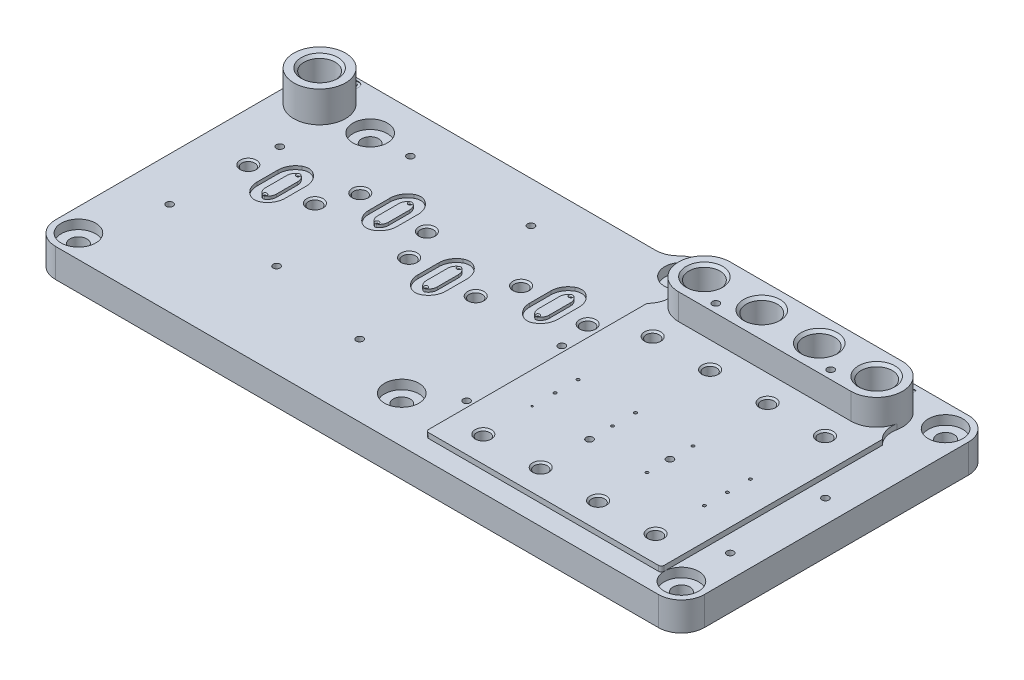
SolidWorks part; units mm, degrees
ref_plane "X_Y" through (0, 0, 0) normal (0, 0, 1) x (1, 0, 0)
ref_plane "Z_X" through (0, 0, 0) normal (0, 1, 0) x (1, 0, 0)
ref_plane "Y_Z" through (0, 0, 0) normal (1, 0, 0) x (0, 0, -1)
ref_plane "X_Y-_6021_master" through (0, 0, 0) normal (0, 0, 1) x (1, 0, 0)
ref_plane "Z_X_peltier-_6021_master" through (0, 0, 0) normal (0, 1, 0) x (1, 0, 0)
ref_plane "Y_Z-_6021_master" through (0, 0, 0) normal (1, 0, 0) x (0, 0, -1)
sketch "zx_sketch-_6021_master" plane through (0, 0, 0) normal (0, 1, 0) x (1, 0, 0)
  line L0 (0, 0) -> (0, 39833.2138) construction
  line L1 (-56.5, 24.66) -> (4, 24.66)
  line L2 (-56.5, 24.66) -> (-56.5, -27)
  line L3 (-56.5, -27) -> (56.5, -27)
  line L4 (56.5, 27) -> (56.5, -27)
  line L5 (0, 0) -> (39833.2138, 0) construction
  line L6 (4, 24.66) -> (4, 27)
  line L11 (4, 27) -> (56.5, 27)
  point P3 (0, -27)
  point P17 (-22.5, 15.66)
  point P18 (22.5, 15.66)
  point P19 (22.5, -15.66)
  point P20 (-22.5, -15.66)
  dimension "D1" = 113
  dimension "D2" = 24.66
  dimension "D3" = 45
  dimension "D4" = 31.32
  dimension "D5" = 27
  dimension "D6" = 2.34
  dimension "D7" = 4
  dimension "D8" = 27
sketch "xy_sketch-_6021_master" plane through (0, 0, 0) normal (0, 0, 1) x (1, 0, 0)
  line L0 (0, 0) -> (0, 5) construction
  line L1 (0, 5) -> (0, 10) construction
  dimension "D1" = 5
  dimension "D2" = 5
ref_plane "zx_lower_plate-_6021_master" through (0, 5, 0) normal (0, 1, 0) x (1, 0, 0)
ref_plane "zx_sensor-_6021_master" through (0, 10, 0) normal (0, 1, 0) x (1, 0, 0)
sketch "zx_sensor_sketch-_6021_master" plane through (0, 10, 0) normal (0, 1, 0) x (1, 0, 0)
  line L0 (-42.2, 3.16) -> (-28.2, 8.66) construction
  line L1 (-28.2, 8.66) -> (-14.2, 3.16) construction
  line L2 (-14.2, 3.16) -> (-0.2, 8.66) construction
  line L3 (-42.2, 4.96) -> (-42.2, -0.8) construction
  line L4 (-28.2, 10.46) -> (-28.2, 4.7) construction
  line L5 (-14.2, 4.96) -> (-14.2, -0.8) construction
  line L6 (-0.2, 10.46) -> (-0.2, 4.7) construction
  line L7 (-42.2, 3.16) -> (-42.2, -0.8) construction
  line L8 (-28.2, 8.66) -> (-28.2, 4.7) construction
  line L9 (-14.2, 3.16) -> (-14.2, -0.8) construction
  line L10 (-0.2, 8.66) -> (-0.2, 4.7) construction
  line L11 (-39.215, 3.16) -> (-45.185, 3.16) construction
  line L12 (-39.215, 7.475) -> (-39.215, -1.155) construction
  line L13 (-44.615, 3.16) -> (-39.785, 3.16) construction
  point P8 (-42.2, 2.08)
  point P16 (-42.2, 3.16)
  point P19 (-39.215, 3.16)
  point P22 (-42.2, 3.16)
  dimension "D3" = 14
  dimension "D4" = 1.08
  dimension "D6" = 5.76
  dimension "D7" = 5.97
  dimension "D9" = 8.63
  dimension "D10" = 4.83
  dimension "D11" = 5.5
sketch "zx_valve_sketch-_6021_master" plane through (0, 10.9, 0) normal (0, 1, 0) x (1, 0, 0)
  line L0 (44, -4.25) -> (34, -4.25) construction
  line L1 (34, -4.25) -> (24, -4.25) construction
  line L2 (24, -4.25) -> (14, -4.25) construction
  line L3 (44, -10.5) -> (44, -6.5) construction
  line L4 (44, -6.5) -> (44, -2.5) construction
  line L5 (34, -2.5) -> (34, -6.5) construction
  line L6 (34, -6.5) -> (34, -10.5) construction
  line L7 (24, -2.5) -> (24, -6.5) construction
  line L8 (24, -6.5) -> (24, -10.5) construction
  line L9 (14, -2.5) -> (14, -6.5) construction
  line L10 (14, -6.5) -> (14, -10.5) construction
  line L11 (44, 10.5) -> (44, -19) construction
  line L12 (34, 10.5) -> (34, -19) construction
  line L14 (24, -19) -> (24, 10.5) construction
  line L17 (14, 10.5) -> (14, -19) construction
  point P20 (44, -4.25)
  dimension "D1" = 10
  dimension "D4" = 8
  dimension "D5" = 2.25
  dimension "D6" = 29.5
sketch "zx_manifold_sketch-_6021_master" plane through (0, 5, 0) normal (0, 1, 0) x (1, 0, 0)
  line L0 (-34.0003, 7.58) -> (-22.3997, 7.58) construction
  line L4 (44, 19.5) -> (34, 19.5) construction
  line L5 (34, 19.5) -> (24, 19.5) construction
  line L6 (24, 19.5) -> (14, 19.5) construction
  line L7 (39, 10.5) -> (39, -7.6132)
  line L9 (-48.0003, 2.08) -> (-36.3997, 2.08) construction
  line L11 (-20.0003, 2.08) -> (-8.3997, 2.08) construction
  line L12 (-6.0003, 7.58) -> (5.6003, 7.58) construction
  line L13 (-48.9, -6.72) -> (-2.2958, -6.72)
  line L15 (14, -6.5) -> (24, -6.5)
  line L17 (-14.2, 4.96) -> (-9.7626, 10.5608)
  line L22 (34, -4.7265) -> (44, -4.7265) construction
  line L23 (44, -4.7265) -> (39, -7.6132) construction
  line L24 (-4.2467, 12.0482) -> (-0.2, 10.46)
  line L26 (44, 22) -> (14, 22)
  line L28 (-48.9, -14.72) -> (-30.3969, -14.72)
  line L30 (10.8896, -9.015) -> (7.7791, -11.53) construction
  line L31 (34, -14.5) -> (45, -14.5)
  line L32 (-22.5, -24) -> (44, -24)
  line L35 (-14.2, -0.8) -> (-18.2467, -2.3882)
  line L38 (-52.7667, 2.6469) -> (-51, 17.5)
  line L39 (-28.2, 4.7) -> (-23.7626, -0.9008)
  line L40 (14, 10.5) -> (22.5, 15.66) construction
  line L43 (49, -19) -> (49, -18.5)
  line L45 (-32.2467, 12.0482) -> (-28.2, 10.46)
  line L46 (-37.7626, 10.5608) -> (-42.2, 4.96)
  line L47 (-42.2, -0.8) -> (-46.2467, -2.3882)
  line L48 (-0.2, 4.7) -> (10.8896, -9.015)
  circle A0 centre (34, 19.5) radius 3.85 construction
  circle A1 centre (44, 19.5) radius 3.85 construction
  circle A2 centre (24, 19.5) radius 3.85 construction
  circle A3 centre (14, 19.5) radius 3.85 construction
  arc A4 (34, -10.5) -> (39, -7.6132) centre (34, -4.7265) ccw
  arc A6 (29, 10.5) -> (34, -2.5) centre (48.4, 10.5) ccw
  arc A7 (44, -10.5) -> (39, -7.6132) centre (44, -4.7265) cw
  arc A8 (44, -2.5) -> (49, 10.5) centre (29.6, 10.5) ccw
  arc A11 (45.3208, 21.6226) -> (44, 22) centre (44, 19.5) ccw
  arc A12 (44, -6.5) -> (51.5, 10.5) centre (28.4833, 10.5) ccw
  arc A13 (14, 22) -> (11.6636, 20.3896) centre (14, 19.5) ccw
  arc A15 (34, -14.5) -> (34, -6.5) centre (34, -10.5) cw
  arc A16 (-48.9, -6.72) -> (-48.9, -14.72) centre (-48.9, -10.72) ccw
  arc A17 (44, -24) -> (49, -19) centre (44, -19) ccw
  arc A18 (-22.5, -24) -> (-26.4485, -19.36) centre (-22.5, -20) cw
  arc A19 (-30.3969, -14.72) -> (-26.4485, -19.36) centre (-30.3969, -18.72) cw
  arc A20 (14, -10.5) -> (10.8896, -9.015) centre (14, -6.5) cw
  arc A21 (-4.2467, 12.0482) -> (-9.7626, 10.5608) centre (-6.0003, 7.58) ccw
  circle A22 centre (-51, 17.5) radius 3.85 construction
  arc A23 (-23.7626, -0.9008) -> (-18.2467, -2.3882) centre (-20.0003, 2.08) ccw
  arc A24 (-32.2467, 12.0482) -> (-37.7626, 10.5608) centre (-34.0003, 7.58) ccw
  arc A25 (-46.2467, -2.3882) -> (-52.7667, 2.6469) centre (-48.0003, 2.08) cw
  arc A26 (49, -18.5) -> (45, -14.5) centre (45, -18.5) ccw
  circle A27 centre (-51, 17.5) radius 5.5 construction
  arc A29 (14, 19.5) -> (19, 10.5) centre (8.4, 10.5) cw
  arc A30 (39, 10.5) -> (34, 19.5) centre (28.4, 10.5) ccw
  arc A31 (49, 10.5) -> (44, 19.5) centre (38.4, 10.5) ccw
  arc A32 (29, 10.5) -> (24, 19.5) centre (18.4, 10.5) ccw
  arc A33 (19, 10.5) -> (24, -2.5) centre (38.4, 10.5) ccw
  arc A35 (45.3208, 21.6226) -> (51.5, 10.5) centre (38.4, 10.5) cw
  arc A36 (14, -2.5) -> (11.6636, 20.3896) centre (35.6147, 11.2703) cw
  arc A37 (19.5172, -12.2931) -> (7.7791, -11.53) centre (14, -6.5) cw
  arc A38 (7.7791, -11.53) -> (-2.2958, -6.72) centre (-2.2958, -19.6763) ccw
  arc A39 (24, -10.5) -> (19.5172, -12.2931) centre (24, -17) ccw
  point P121 (-42.2, 2.08)
  dimension "D1" = 30
  dimension "D2" = 7.7
  dimension "D4" = 2.5
  dimension "D5" = 4
  dimension "D6" = 92.9
  dimension "D9" = 4
  dimension "D15" = 4
  dimension "D18" = 4.8
  dimension "D11" = 4
sketch "zx_screws_sketch-_6021_master" plane through (0, 5, 0) normal (0, 1, 0) x (1, 0, 0)
  line L4 (-34.0003, 7.58) -> (-22.3997, 7.58) construction
  line L5 (-20.0003, 2.08) -> (-8.3997, 2.08) construction
  line L6 (-6.0003, 7.58) -> (5.6003, 7.58) construction
  line L7 (-36.3997, 2.08) -> (-48.0003, 2.08) construction
  line L13 (56.5, 27) -> (56.5, -27) construction
  circle A0 centre (52.5, 23) radius 4 construction
  circle A3 centre (52.5, -23) radius 4 construction
  arc A7 (-52.7667, 2.6469) -> (-46.2467, -2.3882) centre (-48.0003, 2.08) ccw construction
  circle A8 centre (-52.5, -23) radius 4 construction
  point P0 (-0.2, -19)
  point P1 (52.5, -23)
  point P2 (52.5, 23)
  point P3 (6.6, 23)
  point P4 (-52.5, -23)
  point P5 (-42.2, 17.5)
ref_plane "yz_sensor-_6021_master" through (-42.2, 0, 0) normal (1, 0, 0) x (0, 0, -1)
ref_plane "zx_valve-_6021_master" through (0, 10.9, 0) normal (0, 1, 0) x (1, 0, 0)
ref_plane "zx_sensor_shelf-_6021_master" through (0, 12.391, 0) normal (0, 1, 0) x (1, 0, 0)
sketch "xz_cover-_6021_master" plane through (0, 0, 0) normal (0, 1, 0) x (1, 0, 0)
  line L1 (-63, -36.79) -> (63, -36.79)
  line L2 (-71.85, -27.94) -> (-71.85, 30.02)
  line L3 (-71.85, 30.02) -> (71.85, 30.02)
  line L4 (71.85, -27.94) -> (71.85, 30.02)
  line L5 (-71.85, -36.79) -> (71.85, 30.02) construction
  line L6 (-71.85, 30.02) -> (71.85, -36.79) construction
  line L7 (0, -1003.385) -> (0, 48996.615) construction
  arc A0 (71.85, -27.94) -> (63, -36.79) centre (63, -27.94) cw
  arc A1 (-63, -36.79) -> (-71.85, -27.94) centre (-63, -27.94) cw
  circle A2 centre (-64.495, 5.21) radius 3.6
  circle A3 centre (64.495, 5.21) radius 3.6
  point P0 (0, -3.385)
  dimension "D4" = 8.85
  dimension "D5" = 42
  dimension "D7" = 7.2
  dimension "D1" = 66.81
  dimension "D2" = 143.7
  dimension "D6" = 128.99
inserted part "_6021_master"
sketch "Sketch7" plane through (0, 5, 0) normal (0, 1, 0) x (1, 0, 0)
  line L0 (-56.5, -27) -> (56.5, -27) construction
  line L1 (56.5, 27) -> (56.5, -27) construction
  line L2 (4, 27) -> (56.5, 27) construction
  line L3 (4, 24.66) -> (4, 27) construction
  line L4 (-56.5, 24.66) -> (4, 24.66) construction
  line L5 (-56.5, 24.66) -> (-56.5, -27) construction
  line L6 (-56.5, -27) -> (56.5, -27)
  line L7 (56.5, 27) -> (56.5, -27)
  line L8 (4, 27) -> (56.5, 27)
  line L9 (4, 24.66) -> (4, 27)
  line L10 (-56.5, 24.66) -> (4, 24.66)
  line L11 (-56.5, 24.66) -> (-56.5, -27)
  circle A0 centre (-42.2, 4.96) radius 0.15
  circle A1 centre (-42.2, -0.8) radius 0.15
  circle A2 centre (-28.2, 10.46) radius 0.15
  circle A3 centre (-28.2, 4.7) radius 0.15
  circle A4 centre (-14.2, 4.96) radius 0.15
  circle A5 centre (-14.2, -0.8) radius 0.15
  circle A6 centre (-0.2, 10.46) radius 0.15
  circle A7 centre (-0.2, 4.7) radius 0.15
  circle A8 centre (14, -2.5) radius 0.25
  circle A9 centre (14, -6.5) radius 0.25
  circle A10 centre (14, -10.5) radius 0.15
  circle A11 centre (24, -2.5) radius 0.25
  circle A12 centre (24, -6.5) radius 0.25
  circle A13 centre (24, -10.5) radius 0.6
  circle A14 centre (34, -2.5) radius 0.25
  circle A15 centre (34, -6.5) radius 0.6
  circle A16 centre (34, -10.5) radius 0.25
  circle A17 centre (44, -2.5) radius 0.25
  circle A18 centre (44, -6.5) radius 0.25
  circle A19 centre (44, -10.5) radius 0.25
  circle A20 centre (-51, 17.5) radius 0.25
  circle A21 centre (14, 19.5) radius 0.25
  circle A22 centre (24, 19.5) radius 0.25
  circle A23 centre (34, 19.5) radius 0.25
  circle A24 centre (44, 19.5) radius 0.25
  dimension "D1" = 0.3
  dimension "D2" = 0.5
  dimension "D3" = 1.2
extrude "Boss-Extrude1" add sketch "Sketch7" along normal up to surface (5 mm away)
sketch "Sketch8" plane through (0, 10, 0) normal (0, 1, 0) x (1, 0, 0)
  line L2 (14, 24) -> (44, 24)
  line L3 (14, 15) -> (44, 15)
  circle A0 centre (-51, 17.5) radius 4.5
  arc A1 (14, 24) -> (14, 15) centre (14, 19.5) ccw
  arc A2 (44, 24) -> (44, 15) centre (44, 19.5) cw
  circle A3 centre (44, 19.5) radius 0.25 construction
  circle A4 centre (34, 19.5) radius 0.25 construction
  circle A5 centre (24, 19.5) radius 0.25 construction
  circle A6 centre (14, 19.5) radius 0.25 construction
  circle A7 centre (-51, 17.5) radius 0.25 construction
  circle A8 centre (44, 19.5) radius 0.25
  circle A9 centre (34, 19.5) radius 0.25
  circle A10 centre (24, 19.5) radius 0.25
  circle A11 centre (14, 19.5) radius 0.25
  circle A12 centre (-51, 17.5) radius 0.25
  dimension "D1" = 9
extrude "Boss-Extrude2" add sketch "Sketch8" along normal blind 5.4
sketch "Sketch17" plane through (0, 10, 0) normal (0, 1, 0) x (1, 0, 0)
  line L1 (8.5, 15) -> (49.5, 15)
  line L2 (8.5, 15) -> (8.5, -23.5)
  line L3 (8.5, -23.5) -> (49.5, -23.5)
  line L4 (49.5, 15) -> (49.5, -23.5)
  line L11 (34, -4.25) -> (24, -4.25) construction
  line L31 (14, 15) -> (44, 15) construction
  circle A0 centre (44, -2.5) radius 0.25 construction
  circle A1 centre (34, -2.5) radius 0.25 construction
  circle A2 centre (24, -2.5) radius 0.25 construction
  circle A3 centre (14, -2.5) radius 0.25 construction
  circle A4 centre (44, -2.5) radius 0.25
  circle A5 centre (34, -2.5) radius 0.25
  circle A6 centre (24, -2.5) radius 0.25
  circle A7 centre (14, -2.5) radius 0.25
  circle A8 centre (44, -6.5) radius 0.25 construction
  circle A9 centre (34, -6.5) radius 0.6 construction
  circle A10 centre (24, -6.5) radius 0.25 construction
  circle A11 centre (14, -6.5) radius 0.25 construction
  circle A12 centre (44, -6.5) radius 0.25
  circle A13 centre (34, -6.5) radius 0.6
  circle A14 centre (24, -6.5) radius 0.25
  circle A15 centre (14, -6.5) radius 0.25
  circle A16 centre (44, -10.5) radius 0.25 construction
  circle A17 centre (34, -10.5) radius 0.25 construction
  circle A18 centre (24, -10.5) radius 0.6 construction
  circle A19 centre (14, -10.5) radius 0.15 construction
  circle A20 centre (44, -10.5) radius 0.25
  circle A21 centre (34, -10.5) radius 0.25
  circle A22 centre (24, -10.5) radius 0.6
  circle A23 centre (14, -10.5) radius 0.15
  circle A27 centre (44, 19.5) radius 0.25 construction
  circle A28 centre (34, 19.5) radius 0.25 construction
  circle A29 centre (24, 19.5) radius 0.25 construction
  circle A30 centre (14, 19.5) radius 0.25 construction
  circle A32 centre (44, 19.5) radius 0.25
  circle A33 centre (34, 19.5) radius 0.25
  circle A34 centre (24, 19.5) radius 0.25
  circle A35 centre (14, 19.5) radius 0.25
  point P51 (29, -23.5)
  point P60 (29, -4.25)
  point P64 (49.5, -4.25)
  dimension "D1" = 38.5
  dimension "D2" = 41
extrude "Boss-Extrude3" add sketch "Sketch17" along normal blind 0.9
hole_wizard "1/4-28 Tapped Hole1" positions "Sketch9" profile "Sketch10" tap size "1/4-28" standard "ANSI Inch"
sketch "Sketch9" plane through (0, 15.4, 0) normal (0, 1, 0) x (1, 0, 0)
  point P0 (-51, 17.5)
  point P3 (14, 19.5)
  point P6 (24, 19.5)
  point P9 (34, 19.5)
  point P12 (44, 19.5)
sketch "Sketch10" plane through (-51, 15.4, -17.5) normal (1, 0, 0) x (0, 0, 1)
  line L0 (0, 0) -> (0, 8.89)
  line L1 (0, 8.89) -> (2.7051, 8.89)
  line L2 (2.7051, 8.89) -> (2.7051, 0.4699)
  line L3 (2.7051, 0.4699) -> (3.175, 0)
  line L5 (3.175, 0) -> (0, 0)
  line L6 (-2.7051, 0.4699) -> (-3.175, 0) construction
  line L10 (0, 8.89) -> (-2.7051, 8.89) construction
  line L11 (0, -6.35) -> (0, 107.95) construction
  dimension "Tap Drill Dia." = 5.4102
  dimension "Tap Drill Depth" = 8.89
  dimension "Near C'Sink Dia." = 6.35
  dimension "Near C'Sink Angle" = 90
  dimension "Drill Angle" = 180
sketch "Sketch29" plane through (0, 10, 0) normal (0, 1, 0) x (1, 0, 0)
  line L4 (8.5, 15) -> (8.5, -23.5)
  line L5 (8.5, -23.5) -> (49.5, -23.5)
  line L6 (49.5, 15) -> (49.5, -23.5)
  line L7 (8.5, 15) -> (49.5, 15)
  line L8 (34, -4.25) -> (24, -4.25) construction
  point P5 (29, -4.25)
  point P7 (29, -23.5)
  point P8 (49.5, -4.25)
  dimension "D1" = 38.5
  dimension "D2" = 41
hole_wizard "CBORE for #4 Binding Head Machine Screw1" positions "Sketch11" profile "Sketch12" counterbore size "#4" standard "ANSI Inch"
sketch "Sketch11" plane through (0, 10, 0) normal (0, 1, 0) x (1, 0, 0)
  point P0 (-42.2, 17.5)
  point P3 (-52.5, -23)
  point P6 (-0.2, -19)
  point P9 (6.6, 23)
  point P12 (52.5, 23)
  point P15 (52.5, -23)
sketch "Sketch12" plane through (-42.2, 10, -17.5) normal (1, 0, 0) x (0, 0, 1)
  line L0 (0, 0) -> (0, 5)
  line L1 (0, 5) -> (1.4732, 5)
  line L3 (1.4732, 5) -> (1.4732, 1.6002)
  line L4 (1.4732, 1.6002) -> (2.9997, 1.6002)
  line L5 (2.9997, 1.6002) -> (2.9997, 0)
  line L7 (2.9997, 0) -> (0, 0)
  line L11 (0, -6.35) -> (0, 107.95) construction
  dimension "Thru Hole Dia." = 2.9464
  dimension "Thru Hole Depth" = 5
  dimension "C'Bore Dia." = 5.9995
  dimension "C'Bore Depth" = 1.6002
hole_wizard "#4-40 Tapped Hole1" positions "Sketch13" profile "Sketch14" tap size "#4-40" standard "ANSI Inch"
sketch "Sketch13" plane through (0, 10, 0) normal (0, 1, 0) x (1, 0, 0)
  point P0 (-48.0003, 2.08)
  point P3 (-36.3997, 2.08)
  point P6 (-34.0003, 7.58)
  point P9 (-22.3997, 7.58)
  point P12 (-20.0003, 2.08)
  point P15 (-8.3997, 2.08)
  point P18 (-6.0003, 7.58)
  point P21 (5.6003, 7.58)
sketch "Sketch14" plane through (-48.0003, 10, -2.08) normal (1, 0, 0) x (0, 0, 1)
  line L0 (0, 0) -> (0, 5)
  line L1 (0, 5) -> (1.1303, 5)
  line L2 (1.1303, 5) -> (1.1303, 0.2921)
  line L3 (1.1303, 0.2921) -> (1.4224, 0)
  line L5 (1.4224, 0) -> (0, 0)
  line L6 (-1.1303, 0.2921) -> (-1.4224, 0) construction
  line L11 (0, -6.35) -> (0, 107.95) construction
  dimension "Thru Tap Drill Dia." = 2.2606
  dimension "Thru Tap Drill Depth" = 5
  dimension "Near C'Sink Dia." = 2.8448
  dimension "Near C'Sink Angle" = 90
hole_wizard "#4-40 Tapped Hole2" positions "Sketch18" profile "Sketch19" tap size "#4-40" standard "ANSI Inch"
sketch "Sketch18" plane through (0, 10.9, 0) normal (0, 1, 0) x (1, 0, 0)
  point P0 (14, 10.5)
  point P3 (24, 10.5)
  point P6 (34, 10.5)
  point P9 (44, 10.5)
  point P12 (14, -19)
  point P15 (24, -19)
  point P18 (34, -19)
  point P21 (44, -19)
sketch "Sketch19" plane through (14, 10.9, -10.5) normal (1, 0, 0) x (0, 0, 1)
  line L0 (0, 0) -> (0, 5.9)
  line L1 (0, 5.9) -> (1.1303, 5.9)
  line L2 (1.1303, 5.9) -> (1.1303, 0.2921)
  line L3 (1.1303, 0.2921) -> (1.4224, 0)
  line L5 (1.4224, 0) -> (0, 0)
  line L6 (-1.1303, 0.2921) -> (-1.4224, 0) construction
  line L11 (0, -6.35) -> (0, 107.95) construction
  dimension "Thru Tap Drill Dia." = 2.2606
  dimension "Thru Tap Drill Depth" = 5.9
  dimension "Near C'Sink Dia." = 2.8448
  dimension "Near C'Sink Angle" = 90
sketch "Sketch15" plane through (0, 10, 0) normal (0, 1, 0) x (1, 0, 0)
  line L1 (-42.2, 4.96) -> (-42.2, -0.8) construction
  line L2 (-46.025, 2.08) -> (-45.0281, 2.08) construction
  line L7 (-41.25, 3.9208) -> (-41.25, 0.2392)
  line L8 (-43.15, 3.9208) -> (-43.15, 0.2392)
  line L9 (-42.8, 3.9208) -> (-42.2, 4.96) construction
  line L10 (-42.2, 4.96) -> (-42.35, 4.96) construction
  arc A0 (-42.375, 5.2631) -> (-42.025, 5.2631) centre (-42.2, 4.96) cw
  circle A1 centre (-42.2, 4.96) radius 0.15 construction
  arc A2 (-42.375, 5.2631) -> (-43.15, 3.9208) centre (-41.6, 3.9208) ccw
  arc A3 (-42.025, 5.2631) -> (-41.25, 3.9208) centre (-42.8, 3.9208) cw
  arc A4 (-42.025, -1.1031) -> (-41.25, 0.2392) centre (-42.8, 0.2392) ccw
  arc A5 (-42.375, -1.1031) -> (-43.15, 0.2392) centre (-41.6, 0.2392) cw
  arc A6 (-42.375, -1.1031) -> (-42.025, -1.1031) centre (-42.2, -0.8) ccw
  point P12 (-42.2, 2.08)
  dimension "D1" = 1.9
  dimension "D3" = 0.2
  dimension "D2" = 60
extrude "flowcell_cut" cut sketch "Sketch15" against normal blind 0.1
chamfer "Chamfer1" distance 0.2 angle 45 2 edges at (-42.2, 9.9, 0.65) (-42.2, 9.9, -5.11)
sketch "Sketch16" plane through (0, 10, 0) normal (0, 1, 0) x (1, 0, 0)
  line L2 (-41.25, 0.2392) -> (-41.25, 3.9208)
  line L3 (-43.15, 3.9208) -> (-43.15, 0.2392)
  line L8 (-41.25, 0.2392) -> (-41.25, 3.9208)
  line L9 (-43.15, 3.9208) -> (-43.15, 0.2392)
  line L64 (-39.75, 0.2392) -> (-39.75, 3.9208)
  line L65 (-44.65, 3.9208) -> (-44.65, 0.2392)
  line L66 (-39.75, 0.2392) -> (-39.75, 3.9208)
  line L67 (-44.65, 3.9208) -> (-44.65, 0.2392)
  arc A6 (-41.25, 3.9208) -> (-42.025, 5.2631) centre (-42.8, 3.9208) ccw
  arc A7 (-42.025, -1.1031) -> (-41.25, 0.2392) centre (-42.8, 0.2392) ccw
  arc A8 (-42.375, -1.1031) -> (-42.025, -1.1031) centre (-42.2, -0.8) ccw
  arc A9 (-43.15, 0.2392) -> (-42.375, -1.1031) centre (-41.6, 0.2392) ccw
  arc A10 (-42.375, 5.2631) -> (-43.15, 3.9208) centre (-41.6, 3.9208) ccw
  arc A11 (-42.375, -1.1031) -> (-42.025, -1.1031) centre (-42.2, -0.8) ccw
  arc A24 (-41.25, 3.9208) -> (-42.025, 5.2631) centre (-42.8, 3.9208) ccw
  arc A25 (-42.025, -1.1031) -> (-41.25, 0.2392) centre (-42.8, 0.2392) ccw
  arc A27 (-43.15, 0.2392) -> (-42.375, -1.1031) centre (-41.6, 0.2392) ccw
  arc A28 (-42.375, 5.2631) -> (-43.15, 3.9208) centre (-41.6, 3.9208) ccw
  arc A30 (-39.75, 3.9208) -> (-41.275, 6.5621) centre (-42.8, 3.9208) ccw
  arc A31 (-41.275, -2.4021) -> (-39.75, 0.2392) centre (-42.8, 0.2392) ccw
  arc A32 (-43.125, -2.4021) -> (-41.275, -2.4021) centre (-42.2, -0.8) ccw
  arc A33 (-44.65, 0.2392) -> (-43.125, -2.4021) centre (-41.6, 0.2392) ccw
  arc A34 (-43.125, 6.5621) -> (-44.65, 3.9208) centre (-41.6, 3.9208) ccw
  arc A35 (-43.125, -2.4021) -> (-41.275, -2.4021) centre (-42.2, -0.8) ccw
  arc A36 (-39.75, 3.9208) -> (-41.275, 6.5621) centre (-42.8, 3.9208) ccw
  arc A37 (-41.275, -2.4021) -> (-39.75, 0.2392) centre (-42.8, 0.2392) ccw
  arc A39 (-44.65, 0.2392) -> (-43.125, -2.4021) centre (-41.6, 0.2392) ccw
  arc A40 (-43.125, 6.5621) -> (-44.65, 3.9208) centre (-41.6, 3.9208) ccw
  arc A44 (-41.275, 6.5621) -> (-43.125, 6.5621) centre (-42.2, 4.96) ccw
  arc A45 (-41.275, 6.5621) -> (-43.125, 6.5621) centre (-42.2, 4.96) ccw
  arc A46 (-42.025, 5.2631) -> (-42.375, 5.2631) centre (-42.2, 4.96) ccw
  arc A47 (-42.025, 5.2631) -> (-42.375, 5.2631) centre (-42.2, 4.96) ccw
  dimension "D2" = 0
  dimension "D4" = 1.5
extrude "gland_cut" cut sketch "Sketch16" against normal blind 0.6
pattern_linear "LPattern17" count 4 spacing 14 along (1, 0, 0) count 2 spacing 5.5 of "gland_cut", "flowcell_cut"
pattern_linear "LPattern19" count 4 spacing 14 along (1, 0, 0) count 2 spacing 5.5 of "Chamfer1"
sketch "Sketch20" plane through (0, 5, 0) normal (0, -1, 0) x (1, 0, 0)
  line L2 (10.7729, 9.1093) -> (-0.3166, -4.6057)
  line L3 (10.7729, 9.1093) -> (-0.3166, -4.6057)
  line L4 (-42.3176, -5.0531) -> (-37.8802, -10.6539)
  line L5 (-32.1919, -12.1878) -> (-28.1452, -10.5996)
  line L6 (-42.3176, -5.0531) -> (-37.8802, -10.6539)
  line L7 (-32.1919, -12.1878) -> (-28.1452, -10.5996)
  line L8 (-42.0824, -4.8669) -> (-37.645, -10.4676)
  line L9 (-32.3015, -11.9086) -> (-28.2548, -10.3204)
  line L10 (-42.0824, -4.8669) -> (-37.645, -10.4676)
  line L11 (-32.3015, -11.9086) -> (-28.2548, -10.3204)
  line L12 (11.0062, 8.9207) -> (-0.0834, -4.7943)
  line L13 (11.0062, 8.9207) -> (-0.0834, -4.7943)
  line L14 (-18.3015, 2.2486) -> (-14.2548, 0.6604)
  line L15 (-28.0824, -4.7931) -> (-23.645, 0.8076)
  line L16 (-18.3015, 2.2486) -> (-14.2548, 0.6604)
  line L17 (-28.0824, -4.7931) -> (-23.645, 0.8076)
  line L18 (-18.1919, 2.5278) -> (-14.1452, 0.9396)
  line L19 (-28.3176, -4.6069) -> (-23.8802, 0.9939)
  line L20 (-18.1919, 2.5278) -> (-14.1452, 0.9396)
  line L21 (-28.3176, -4.6069) -> (-23.8802, 0.9939)
  line L23 (-42.3176, -5.0531) -> (-42.0824, -4.8669)
  line L24 (-4.1919, -12.1878) -> (-0.1452, -10.5996)
  line L25 (-14.3176, -5.0531) -> (-9.8802, -10.6539)
  line L26 (-4.1919, -12.1878) -> (-0.1452, -10.5996)
  line L27 (-14.3176, -5.0531) -> (-9.8802, -10.6539)
  line L28 (-4.3015, -11.9086) -> (-0.2548, -10.3204)
  line L29 (-14.0824, -4.8669) -> (-9.645, -10.4676)
  line L30 (-4.3015, -11.9086) -> (-0.2548, -10.3204)
  line L31 (-14.0824, -4.8669) -> (-9.645, -10.4676)
  line L36 (-28.1452, -10.5996) -> (-28.2548, -10.3204)
  line L37 (-28.0824, -4.7931) -> (-28.3176, -4.6069)
  line L38 (-14.2548, 0.6604) -> (-14.1452, 0.9396)
  line L39 (-14.3176, -5.0531) -> (-14.0824, -4.8669)
  line L40 (-0.1452, -10.5996) -> (-0.2548, -10.3204)
  line L41 (-0.0834, -4.7943) -> (-0.3166, -4.6057)
  line L42 (14, 10.35) -> (14, 10.65)
  arc A2 (-37.8802, -10.6539) -> (-32.1919, -12.1878) centre (-34.0003, -7.58) ccw
  arc A3 (-37.8802, -10.6539) -> (-32.1919, -12.1878) centre (-34.0003, -7.58) ccw
  arc A4 (-37.645, -10.4676) -> (-32.3015, -11.9086) centre (-34.0003, -7.58) ccw
  arc A5 (-37.645, -10.4676) -> (-32.3015, -11.9086) centre (-34.0003, -7.58) ccw
  arc A7 (-18.3015, 2.2486) -> (-23.645, 0.8076) centre (-20.0003, -2.08) ccw
  arc A8 (-18.3015, 2.2486) -> (-23.645, 0.8076) centre (-20.0003, -2.08) ccw
  arc A9 (-18.1919, 2.5278) -> (-23.8802, 0.9939) centre (-20.0003, -2.08) ccw
  arc A10 (-18.1919, 2.5278) -> (-23.8802, 0.9939) centre (-20.0003, -2.08) ccw
  arc A11 (14, 10.65) -> (10.7729, 9.1093) centre (14, 6.5) ccw
  arc A12 (-9.8802, -10.6539) -> (-4.1919, -12.1878) centre (-6.0003, -7.58) ccw
  arc A13 (-9.8802, -10.6539) -> (-4.1919, -12.1878) centre (-6.0003, -7.58) ccw
  arc A14 (-9.645, -10.4676) -> (-4.3015, -11.9086) centre (-6.0003, -7.58) ccw
  arc A15 (-9.645, -10.4676) -> (-4.3015, -11.9086) centre (-6.0003, -7.58) ccw
  arc A16 (14, 10.65) -> (10.7729, 9.1093) centre (14, 6.5) ccw
  arc A17 (14, 10.35) -> (11.0062, 8.9207) centre (14, 6.5) ccw
  arc A19 (14, 10.35) -> (11.0062, 8.9207) centre (14, 6.5) ccw
  dimension "D1" = 0.15
  dimension "D2" = 0.15
  dimension "D3" = 0.15
  dimension "D4" = 0.15
  dimension "D5" = 0.15
  dimension "D6" = 0.15
  dimension "D7" = 0.15
  dimension "D8" = 0.15
extrude "manifold_cut1" cut sketch "Sketch20" against normal blind 0.5
sketch "Sketch21" plane through (0, 5, 0) normal (0, -1, 0) x (1, 0, 0)
  line L0 (14, 2.5) -> (14, 6.5) construction
  line L1 (24, 6.5) -> (24, 10.5) construction
  line L2 (14, 6.25) -> (24, 6.25)
  line L3 (14, 6.25) -> (14, 6.75)
  line L4 (-53.015, -2.6765) -> (-51.2483, -17.5295)
  line L5 (-42.1087, 1.0327) -> (-46.1553, 2.6209)
  line L6 (-53.015, -2.6765) -> (-51.2483, -17.5295)
  line L7 (-42.2018, 1.0693) -> (-46.1553, 2.6209)
  line L8 (-52.5185, -2.6174) -> (-50.7517, -17.4705)
  line L9 (-42.2913, 0.5673) -> (-46.338, 2.1555)
  line L10 (-52.5185, -2.6174) -> (-50.7517, -17.4705)
  line L11 (-42.3844, 0.6038) -> (-46.338, 2.1555)
  line L12 (14, 6.75) -> (24, 6.75)
  line L13 (24, 6.25) -> (24, 6.75)
  line L22 (-51.2483, -17.5295) -> (-50.7517, -17.4705)
  line L23 (39.25, -10.5) -> (39.25, 7.5455)
  line L24 (39.25, -10.5) -> (39.25, 7.5455)
  line L25 (38.75, -10.5) -> (38.75, 7.6795)
  line L26 (38.75, -10.5) -> (38.75, 7.5455)
  line L27 (-42.2, 0.8) -> (-46.2467, 2.3882) construction
  line L28 (13.7892, 2.6343) -> (14.2108, 2.3657)
  line L29 (14.1321, -19.7123) -> (13.8679, -19.2877)
  line L30 (23.8144, 2.6675) -> (24.1856, 2.3325)
  line L31 (34.1856, 2.3325) -> (33.8144, 2.6675)
  line L32 (24.1321, -19.7123) -> (23.8679, -19.2877)
  line L33 (34.1321, -19.7123) -> (33.8679, -19.2877)
  line L34 (44.1321, -19.7123) -> (43.8679, -19.2877)
  line L35 (34, 10.25) -> (34, 10.75)
  line L36 (44, 10.25) -> (44, 10.75)
  line L38 (43.8144, 2.3325) -> (44.1856, 2.6675)
  line L41 (44.1685, 6.6846) -> (43.8315, 6.3154)
  line L43 (14, -22.25) -> (44, -22.25)
  line L44 (14, -22.25) -> (44, -22.25)
  line L45 (14, -21.75) -> (44, -21.75)
  line L46 (14, -21.75) -> (44, -21.75)
  arc A0 (14, 2.5) -> (11.6636, -20.3896) centre (35.6147, -11.2703) ccw construction
  circle A1 centre (-42.2, 0.8) radius 0.15 construction
  arc A2 (-46.1553, 2.6209) -> (-53.015, -2.6765) centre (-48.0003, -2.08) ccw
  arc A3 (-46.1553, 2.6209) -> (-53.015, -2.6765) centre (-48.0003, -2.08) ccw
  arc A4 (-46.338, 2.1555) -> (-52.5185, -2.6174) centre (-48.0003, -2.08) ccw
  arc A5 (-46.338, 2.1555) -> (-52.5185, -2.6174) centre (-48.0003, -2.08) ccw
  arc A15 (24.1856, 2.3325) -> (19.25, -10.5) centre (38.4, -10.5) ccw
  arc A16 (14.1321, -19.7123) -> (19.25, -10.5) centre (8.4, -10.5) ccw
  arc A41 (24.1856, 2.3325) -> (19.25, -10.5) centre (38.4, -10.5) ccw
  arc A42 (14.1321, -19.7123) -> (19.25, -10.5) centre (8.4, -10.5) ccw
  arc A43 (23.8144, 2.6675) -> (18.75, -10.5) centre (38.4, -10.5) ccw
  arc A44 (13.8679, -19.2877) -> (18.75, -10.5) centre (8.4, -10.5) ccw
  arc A45 (23.8144, 2.6675) -> (18.75, -10.5) centre (38.4, -10.5) ccw
  arc A46 (13.8679, -19.2877) -> (18.75, -10.5) centre (8.4, -10.5) ccw
  arc A48 (39, 8.0855) -> (34, 10.75) centre (34, 4.7265) ccw
  arc A49 (23.8679, -19.2877) -> (28.75, -10.5) centre (18.4, -10.5) ccw
  arc A50 (33.8144, 2.6675) -> (28.75, -10.5) centre (48.4, -10.5) ccw
  arc A51 (23.8679, -19.2877) -> (28.75, -10.5) centre (18.4, -10.5) ccw
  arc A52 (33.8144, 2.6675) -> (28.75, -10.5) centre (48.4, -10.5) ccw
  arc A53 (24.1321, -19.7123) -> (29.25, -10.5) centre (18.4, -10.5) ccw
  arc A54 (34.1856, 2.3325) -> (29.25, -10.5) centre (48.4, -10.5) ccw
  arc A55 (24.1321, -19.7123) -> (29.25, -10.5) centre (18.4, -10.5) ccw
  arc A56 (34.1856, 2.3325) -> (29.25, -10.5) centre (48.4, -10.5) ccw
  arc A57 (38.75, 7.5455) -> (34, 10.25) centre (34, 4.7265) ccw
  arc A61 (51.75, -10.5) -> (44.1685, 6.6846) centre (28.4833, -10.5) ccw
  arc A62 (44, 10.25) -> (39.25, 7.5455) centre (44, 4.7265) ccw
  arc A63 (34.1321, -19.7123) -> (39.25, -10.5) centre (28.4, -10.5) ccw
  arc A64 (44, 10.25) -> (39.25, 7.5455) centre (44, 4.7265) ccw
  arc A65 (34.1321, -19.7123) -> (39.25, -10.5) centre (28.4, -10.5) ccw
  arc A66 (44, 10.75) -> (38.75, 7.6795) centre (44, 4.7265) ccw
  arc A67 (33.8679, -19.2877) -> (38.75, -10.5) centre (28.4, -10.5) ccw
  arc A68 (44, 10.75) -> (39, 8.0855) centre (44, 4.7265) ccw
  arc A69 (33.8679, -19.2877) -> (38.75, -10.5) centre (28.4, -10.5) ccw
  arc A74 (45.4528, -21.8349) -> (51.75, -10.5) centre (38.4, -10.5) ccw
  arc A75 (-42.3844, 0.6038) -> (-42.2018, 1.0693) centre (-42.2931, 0.8365) ccw
  arc A76 (44, -22.25) -> (45.4528, -21.8349) centre (44, -19.5) ccw
  arc A77 (44.1321, -19.7123) -> (49.25, -10.5) centre (38.4, -10.5) ccw
  arc A78 (49.25, -10.5) -> (44.1856, 2.6675) centre (29.6, -10.5) ccw
  arc A79 (44.1321, -19.7123) -> (49.25, -10.5) centre (38.4, -10.5) ccw
  arc A80 (49.25, -10.5) -> (44.1856, 2.6675) centre (29.6, -10.5) ccw
  arc A81 (43.8679, -19.2877) -> (48.75, -10.5) centre (38.4, -10.5) ccw
  arc A82 (48.75, -10.5) -> (43.8144, 2.3325) centre (29.6, -10.5) ccw
  arc A83 (43.8679, -19.2877) -> (48.75, -10.5) centre (38.4, -10.5) ccw
  arc A84 (48.75, -10.5) -> (43.8144, 2.3325) centre (29.6, -10.5) ccw
  arc A85 (11.43, -20.4785) -> (14, -22.25) centre (14, -19.5) ccw
  arc A86 (13.7892, 2.6343) -> (11.43, -20.4785) centre (35.6147, -11.2703) ccw
  arc A87 (51.75, -10.5) -> (44.1685, 6.6846) centre (28.4833, -10.5) ccw
  arc A88 (45.4528, -21.8349) -> (51.75, -10.5) centre (38.4, -10.5) ccw
  arc A89 (44, -22.25) -> (45.4528, -21.8349) centre (44, -19.5) ccw
  arc A90 (11.43, -20.4785) -> (14, -22.25) centre (14, -19.5) ccw
  arc A91 (13.7892, 2.6343) -> (11.43, -20.4785) centre (35.6147, -11.2703) ccw
  arc A92 (51.25, -10.5) -> (43.8315, 6.3154) centre (28.4833, -10.5) ccw
  arc A93 (45.1887, -21.4104) -> (51.25, -10.5) centre (38.4, -10.5) ccw
  arc A94 (44, -21.75) -> (45.1887, -21.4104) centre (44, -19.5) ccw
  arc A95 (11.8973, -20.3006) -> (14, -21.75) centre (14, -19.5) ccw
  arc A96 (14.2108, 2.3657) -> (11.8973, -20.3006) centre (35.6147, -11.2703) ccw
  arc A97 (51.25, -10.5) -> (43.8315, 6.3154) centre (28.4833, -10.5) ccw
  arc A98 (45.1887, -21.4104) -> (51.25, -10.5) centre (38.4, -10.5) ccw
  arc A99 (44, -21.75) -> (45.1887, -21.4104) centre (44, -19.5) ccw
  arc A100 (11.8973, -20.3006) -> (14, -21.75) centre (14, -19.5) ccw
  arc A101 (14.2108, 2.3657) -> (11.8973, -20.3006) centre (35.6147, -11.2703) ccw
  dimension "D1" = 0.25
  dimension "D2" = 0.25
  dimension "D3" = 0.25
  dimension "D4" = 0.25
  dimension "D5" = 0.25
  dimension "D6" = 0.25
  dimension "D7" = 0.25
  dimension "D8" = 0.25
  dimension "D9" = 0.25
  dimension "D10" = 0.25
  dimension "D13" = 0.25
  dimension "D14" = 0.25
extrude "manifold_cut2" cut sketch "Sketch21" against normal blind 0.5
sketch "Sketch22" plane through (0, 5, 0) normal (0, -1, 0) x (1, 0, 0)
  line L0 (24, 19) -> (24, -10.5) construction
  line L39 (45, 15.1) -> (34, 15.1)
  line L40 (48.4, 19) -> (48.4, 18.5)
  line L41 (-22.5, 23.4) -> (44, 23.4)
  line L42 (-48.9, 14.12) -> (-30.3969, 14.12)
  line L43 (-2.2958, 7.32) -> (-48.9, 7.32)
  line L44 (45, 15.1) -> (34, 15.1)
  line L45 (48.4, 19) -> (48.4, 18.5)
  line L46 (-22.5, 23.4) -> (44, 23.4)
  line L47 (-48.9, 14.12) -> (-30.3969, 14.12)
  line L48 (-2.2958, 7.32) -> (-48.9, 7.32)
  line L49 (45, 13.9) -> (34, 13.9)
  line L56 (24, 9.9) -> (24, 11.1)
  line L57 (34, 5.9) -> (34, 7.1)
  line L58 (49.6, 19) -> (49.6, 18.5)
  line L59 (-22.5, 24.6) -> (44, 24.6)
  line L60 (-48.9, 15.32) -> (-30.3969, 15.32)
  line L61 (-2.2958, 6.12) -> (-48.9, 6.12)
  line L68 (45, 13.9) -> (34, 13.9)
  line L69 (49.6, 19) -> (49.6, 18.5)
  line L70 (-22.5, 24.6) -> (44, 24.6)
  line L71 (-48.9, 15.32) -> (-30.3969, 15.32)
  line L72 (-2.2958, 6.12) -> (-48.9, 6.12)
  arc A0 (19.931, 12.7276) -> (24, 11.1) centre (24, 17) ccw
  arc A1 (19.1034, 11.8586) -> (24, 9.9) centre (24, 17) ccw
  arc A55 (34, 15.1) -> (34, 5.9) centre (34, 10.5) ccw
  arc A63 (45, 15.1) -> (48.4, 18.5) centre (45, 18.5) ccw
  arc A64 (48.4, 19) -> (44, 23.4) centre (44, 19) ccw
  arc A65 (-22.5, 23.4) -> (-25.8562, 19.456) centre (-22.5, 20) ccw
  arc A66 (-30.3969, 14.12) -> (-25.8562, 19.456) centre (-30.3969, 18.72) ccw
  arc A67 (-48.9, 14.12) -> (-48.9, 7.32) centre (-48.9, 10.72) ccw
  arc A68 (-2.2958, 7.32) -> (7.3126, 11.9073) centre (-2.2958, 19.6763) ccw
  arc A69 (19.931, 12.7276) -> (7.3126, 11.9073) centre (14, 6.5) ccw
  arc A78 (34, 15.1) -> (34, 5.9) centre (34, 10.5) ccw
  arc A79 (45, 15.1) -> (48.4, 18.5) centre (45, 18.5) ccw
  arc A80 (48.4, 19) -> (44, 23.4) centre (44, 19) ccw
  arc A81 (-22.5, 23.4) -> (-25.8562, 19.456) centre (-22.5, 20) ccw
  arc A82 (-30.3969, 14.12) -> (-25.8562, 19.456) centre (-30.3969, 18.72) ccw
  arc A83 (-48.9, 14.12) -> (-48.9, 7.32) centre (-48.9, 10.72) ccw
  arc A84 (-2.2958, 7.32) -> (7.3126, 11.9073) centre (-2.2958, 19.6763) ccw
  arc A85 (19.931, 12.7276) -> (7.3126, 11.9073) centre (14, 6.5) ccw
  arc A87 (34, 13.9) -> (34, 7.1) centre (34, 10.5) ccw
  arc A88 (45, 13.9) -> (49.6, 18.5) centre (45, 18.5) ccw
  arc A89 (49.6, 19) -> (44, 24.6) centre (44, 19) ccw
  arc A90 (-22.5, 24.6) -> (-27.0407, 19.264) centre (-22.5, 20) ccw
  arc A91 (-30.3969, 15.32) -> (-27.0407, 19.264) centre (-30.3969, 18.72) ccw
  arc A92 (-48.9, 15.32) -> (-48.9, 6.12) centre (-48.9, 10.72) ccw
  arc A93 (-2.2958, 6.12) -> (8.2457, 11.1528) centre (-2.2958, 19.6763) ccw
  arc A94 (19.1034, 11.8586) -> (8.2457, 11.1528) centre (14, 6.5) ccw
  arc A96 (34, 13.9) -> (34, 7.1) centre (34, 10.5) ccw
  arc A97 (45, 13.9) -> (49.6, 18.5) centre (45, 18.5) ccw
  arc A98 (49.6, 19) -> (44, 24.6) centre (44, 19) ccw
  arc A99 (-22.5, 24.6) -> (-27.0407, 19.264) centre (-22.5, 20) ccw
  arc A100 (-30.3969, 15.32) -> (-27.0407, 19.264) centre (-30.3969, 18.72) ccw
  arc A101 (-48.9, 15.32) -> (-48.9, 6.12) centre (-48.9, 10.72) ccw
  arc A102 (-2.2958, 6.12) -> (8.2457, 11.1528) centre (-2.2958, 19.6763) ccw
  arc A103 (19.1034, 11.8586) -> (8.2457, 11.1528) centre (14, 6.5) ccw
  dimension "D1" = 0.6
  dimension "D2" = 0.6
extrude "manifold_cut3" cut sketch "Sketch22" against normal blind 1.3
sketch "text" plane through (0, 10, 0) normal (0, 1, 0) x (1, 0, 0)
  line L1 (14, -976.24) -> (14, 49023.76) construction
  line L2 (24, -976.24) -> (24, 49023.76) construction
  line L3 (34, -976.24) -> (34, 49023.76) construction
  line L4 (44, -976.24) -> (44, 49023.76) construction
  line L5 (-51, -983.5) -> (-51, 49016.5) construction
  text T0 "O" font "Verdana" height 1.8
  text T1 "R" font "Verdana" height 1.8
  text T2 "W" font "Verdana" height 1.8
  text T3 "B" font "Verdana" height 1.8
  text T4 "I" font "Segoe UI" height 1.8
  dimension "D1" = 1.05
  dimension "D2" = 4.9
  dimension "D3" = 0.95
  dimension "D4" = 1.4
  dimension "D5" = 0.95
  dimension "D6" = 0.48
  dimension "D7" = 4.9
extrude "text_cut" cut sketch "text" against normal blind 0.1
fillet "Fillet1" radius 4 3 edges at (4, 7.5, -24.66) (14, 10.45, -15) (44, 10.45, -15)
fillet "Fillet2" radius 4 5 edges at (56.5, 7.5, 27) (56.5, 7.5, -27) (-56.5, 7.5, -24.66) (-56.5, 7.5, 27) (4, 7.5, -27)
fillet "Fillet3" radius 0.15 21 edges at (14.9867, 9.95, -24.4) (13.7335, 9.95, -24.4) (14.4125, 9.95, -24.4) (13.2778, 9.95, -24.4) (13.2778, 9.95, -26.2) (24.8393, 9.95, -26.2) (23.7649, 9.95, -26.2) (24.8251, 9.95, -24.4) (23.6556, 9.95, -24.4) (24.3121, 9.95, -24.4) (23.1547, 9.95, -24.4) (25.3114, 9.95, -26.2) (24.2295, 9.95, -26.2) (23.1404, 9.95, -26.2) (22.6684, 9.95, -26.2) (33.2778, 9.95, -26.2) (33.2778, 9.95, -24.4) (44.2387, 9.95, -24.4) (43.7568, 9.95, -24.4) (43.7568, 9.95, -26.2) (44.2387, 9.95, -26.2)
fillet "Fillet4" radius 0.5 2 edges at (49.5, 10.45, 23.5) (8.5, 10.45, 23.5)
hole_wizard "Ø1.2 (1.2) Diameter Hole1" positions "Sketch23" profile "Sketch24" hole size "Ø1.2" standard "ANSI Metric"
sketch "Sketch23" plane through (0, 10, 0) normal (0, 1, 0) x (1, 0, 0)
  line L3 (-48.9, -10.72) -> (-30.2708, -10.72) construction
  line L4 (6.6, -14.5) -> (-12.0292, -14.5) construction
  line L10 (34, -14.5) -> (45, -14.5) construction
  line L11 (-30.2708, -10.72) -> (-12.0292, -14.5) construction
  point P2 (-48.9, -10.72)
  point P5 (-30.2708, -10.72)
  point P7 (-12.0292, -14.5)
  point P9 (6.6, -14.5)
  point P11 (52.5, -14.5)
  point P65 (52.5, 2.08)
sketch "Sketch24" plane through (-48.9, 10, 10.72) normal (1, 0, 0) x (0, 0, 1)
  line L0 (0, 0) -> (0, 4.6605)
  line L1 (0, 4.6605) -> (0.6, 4.3)
  line L2 (0.6, 4.3) -> (0.6, 0)
  line L5 (0.6, 0) -> (0, 0)
  line L10 (0, 4.6605) -> (-0.6, 4.3) construction
  line L11 (0, -6.35) -> (0, 107.95) construction
  dimension "Hole Dia." = 1.2
  dimension "Hole Depth" = 4.3
  dimension "Drill Angle" = 118
hole_wizard "Ø1.2 (1.2) Diameter Hole3" positions "Sketch31" profile "Sketch32" hole size "Ø1.2" standard "ANSI Metric"
sketch "Sketch31" plane through (0, 10, 0) normal (0, 1, 0) x (1, 0, 0)
  line L0 (-34.0003, 7.58) -> (-22.3997, 7.58) construction
  line L1 (-20.0003, 2.08) -> (-8.3997, 2.08) construction
  line L2 (-34.0003, 7.58) -> (-36.3997, 2.08) construction
  point P0 (-48.0003, 7.58)
  point P2 (-35.2, 17.5)
  point P4 (-14.2, 17.5)
  point P6 (6.6, 2.08)
  point P20 (-14.2, 2.08)
  point P27 (-35.2, 4.83)
sketch "Sketch32" plane through (-48.0003, 10, -7.58) normal (1, 0, 0) x (0, 0, 1)
  line L0 (0, 0) -> (0, 4.6605)
  line L1 (0, 4.6605) -> (0.6, 4.3)
  line L2 (0.6, 4.3) -> (0.6, 0)
  line L5 (0.6, 0) -> (0, 0)
  line L10 (0, 4.6605) -> (-0.6, 4.3) construction
  line L11 (0, -6.35) -> (0, 107.95) construction
  dimension "Hole Dia." = 1.2
  dimension "Hole Depth" = 4.3
  dimension "Drill Angle" = 118
hole_wizard "Ø1.2 (1.2) Diameter Hole2" positions "Sketch25" profile "Sketch26" hole size "Ø1.2" standard "ANSI Metric"
sketch "Sketch25" plane through (0, 15.4, 0) normal (0, 1, 0) x (1, 0, 0)
  line L0 (39, 10.5) -> (39, -7.6132) construction
  line L1 (14, 15) -> (44, 15) construction
  point P0 (19, 16.5)
  point P2 (39, 16.5)
  dimension "D1" = 1.5
sketch "Sketch26" plane through (19, 15.4, -16.5) normal (1, 0, 0) x (0, 0, 1)
  line L0 (0, 0) -> (0, 10.0605)
  line L1 (0, 10.0605) -> (0.6, 9.7)
  line L2 (0.6, 9.7) -> (0.6, 0)
  line L5 (0.6, 0) -> (0, 0)
  line L10 (0, 10.0605) -> (-0.6, 9.7) construction
  line L11 (0, -6.35) -> (0, 107.95) construction
  dimension "Hole Dia." = 1.2
  dimension "Hole Depth" = 9.7
  dimension "Drill Angle" = 118
hole_wizard "Ø2.5 (2.5) Diameter Hole1" positions "Sketch27" profile "Sketch28" hole size "Ø2.5" standard "ANSI Metric"
sketch "Sketch27" plane through (0, 19.4, -24.66) normal (0, 0, 1) x (-1, 0, 0)
  line L6 (2.4, 14.4) -> (2.4, 9.4) construction
  line L7 (52.5, 14.4) -> (-52.5, 14.4) construction
  line L8 (52.5, 9.4) -> (-52.5, 9.4) construction
  point P35 (2.4, 11.9)
  dimension "D1" = 2.2
sketch "Sketch28" plane through (-2.4, 7.5, -24.66) normal (1, 0, 0) x (0, 1, 0)
  line L0 (0, 0) -> (0, 25.4111)
  line L1 (0, 25.4111) -> (1.25, 24.66)
  line L2 (1.25, 24.66) -> (1.25, 0)
  line L5 (1.25, 0) -> (0, 0)
  line L10 (0, 25.4111) -> (-1.25, 24.66) construction
  line L11 (0, -6.35) -> (0, 107.95) construction
  dimension "Hole Dia." = 2.5
  dimension "Hole Depth" = 24.66
  dimension "Drill Angle" = 118
